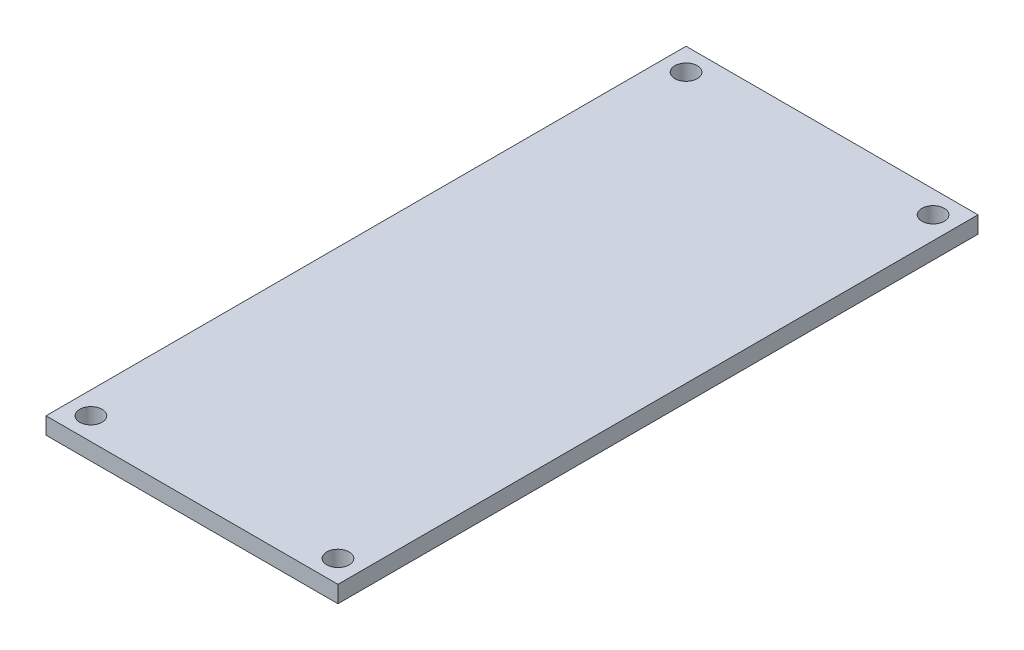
SolidWorks part; units mm, degrees
ref_plane "Front Plane" through (0, 0, 0) normal (0, 0, 1) x (1, 0, 0)
ref_plane "Top Plane" through (0, 0, 0) normal (0, 1, 0) x (1, 0, 0)
ref_plane "Right Plane" through (0, 0, 0) normal (1, 0, 0) x (0, 0, -1)
sketch "Sketch1" plane through (0, 0, 0) normal (0, 1, 0) x (1, 0, 0)
  line L1 (0, 0) -> (26, 0)
  line L2 (0, 0) -> (0, 57)
  line L3 (0, 57) -> (26, 57)
  line L4 (26, 0) -> (26, 57)
  circle A0 centre (24, 2) radius 1
  circle A1 centre (2, 2) radius 1
  circle A2 centre (2, 55) radius 1
  circle A3 centre (24, 55) radius 1
  dimension "D3" = 2
  dimension "D4" = 2
  dimension "D5" = 2
  dimension "D6" = 2
  dimension "D1" = 26
  dimension "D2" = 57
  dimension "D7" = 2
  dimension "D8" = 2
  dimension "D9" = 2
  dimension "D10" = 2
  dimension "D11" = 2
  dimension "D12" = 2
  dimension "D13" = 2
  dimension "D14" = 2
extrude "Boss-Extrude1" add sketch "Sketch1" along normal blind 1.5
